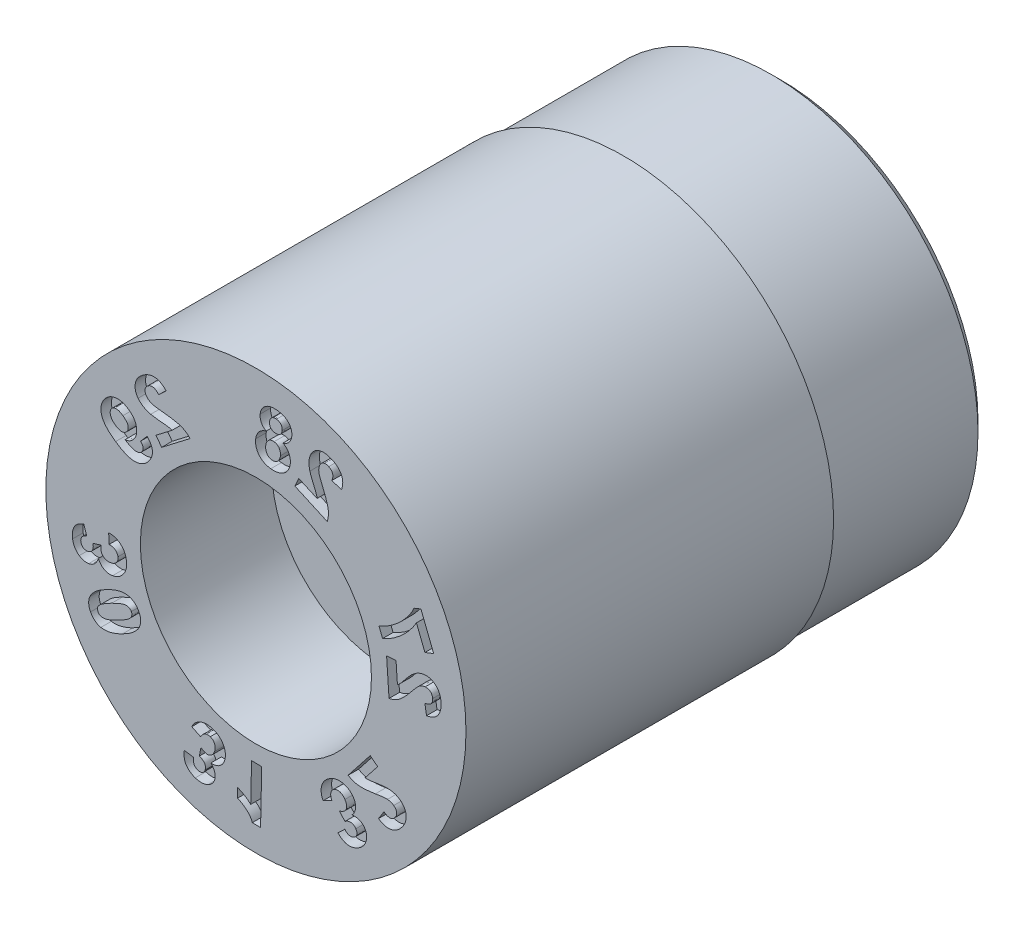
SolidWorks part; units mm, degrees
ref_plane "Front Plane" through (0, 0, 0) normal (0, 0, 1) x (1, 0, 0)
ref_plane "Top Plane" through (0, 0, 0) normal (0, 1, 0) x (1, 0, 0)
ref_plane "Right Plane" through (0, 0, 0) normal (1, 0, 0) x (0, 0, -1)
sketch "Sketch1" plane through (0, 0, 0) normal (1, 0, 0) x (0, 0, -1)
  line L2 (0, 4) -> (0, 2.2)
  line L3 (9.75, 4) -> (0, 4)
  line L4 (-3.7979, 0) -> (49996.2021, 0) construction
  line L8 (10, 1.15) -> (2.5, 1.15)
  line L9 (2.5, 2.2) -> (2.5, 1.15)
  line L10 (2.5, 2.2) -> (0, 2.2)
  line L12 (10, 1.15) -> (10, 3.75)
  line L16 (10, 3.75) -> (9.75, 4)
  dimension "D1" = 10
  dimension "D2" = 45
  dimension "D3" = 0.25
  dimension "D4" = 8
  dimension "D5" = 4.4
  dimension "D6" = 2.5
  dimension "D7" = 2.3
revolve "Revolve1" add sketch "Sketch1" angle 360 about L4
sketch "Sketch4" plane through (0, 0, 0) normal (1, 0, 0) x (0, 0, -1)
  line L0 (0, 0) -> (50000, 0) construction
  line L1 (10, -3.75) -> (10, 3.75) construction
  line L2 (7, 4.935) -> (10, 4.935)
  line L3 (7, 4.935) -> (7, 3.935)
  line L4 (7, 3.935) -> (10, 3.935)
  line L5 (10, 4.935) -> (10, 3.935)
  line L6 (9.75, 4) -> (0, 4) construction
  line L9 (0, 4.4) -> (0, -4.4) construction
  dimension "D1" = 1
  dimension "D2" = 0.065
  dimension "D3" = 7
revolve "Cut-Revolve1" cut sketch "Sketch4" angle 360 about L0
sketch "Sketch6" plane through (0, 0, 0) normal (0, 0, 1) x (1, 0, 0)
  arc A0 (2.5374, -0.2159) -> (2.4907, -0.5305) centre (0, 0) ccw construction
  text T0 "27   28   29   30   31  32" font "Arial" height 1.02
  dimension "D1" = 2.5465
extrude "Cut-Extrude1" cut sketch "Sketch6" against normal blind 0.2
